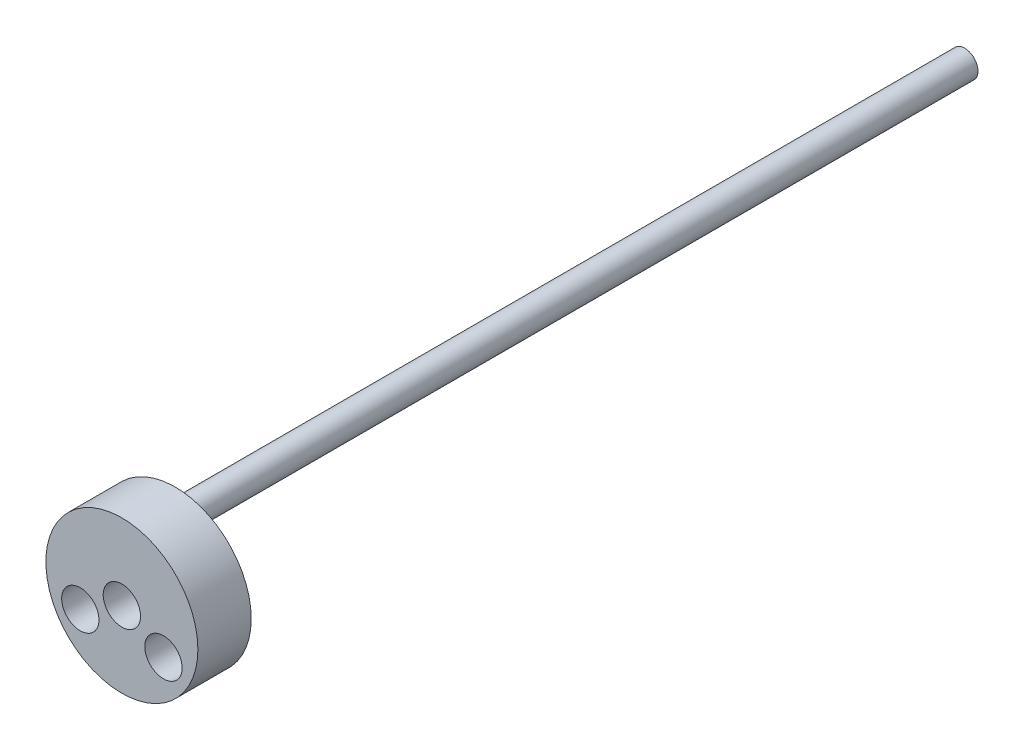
SolidWorks part; units mm, degrees
ref_plane "Face" through (0, 0, 0) normal (0, 0, 1) x (1, 0, 0)
ref_plane "Dessus" through (0, 0, 0) normal (0, 1, 0) x (1, 0, 0)
ref_plane "Droite" through (0, 0, 0) normal (1, 0, 0) x (0, 0, -1)
sketch "Esquisse1" plane through (0, 0, 0) normal (0, 0, 1) x (1, 0, 0)
  circle A0 centre (0, 0) radius 14.25
  circle A1 centre (0, 9) radius 3.5
  circle A2 centre (7.7942, -4.5) radius 3.5
  circle A3 centre (-7.7942, -4.5) radius 3.5
  circle A4 centre (0, 0) radius 3.5
  dimension "D1" = 28.5
  dimension "D2" = 7
  dimension "D4" = 7
  dimension "D3" = 9
extrude "Extrusion1" add sketch "Esquisse1" along normal blind 10
sketch "Esquisse2" plane through (0, 0, 10) normal (0, 0, 1) x (1, 0, 0)
  circle A0 centre (0, 9) radius 3.5 construction
  circle A1 centre (0, 9) radius 3.5
extrude "Extrusion2" add sketch "Esquisse2" against normal blind 8
sketch "Esquisse3" plane through (0, 0, 2) normal (0, 0, -1) x (-1, 0, 0)
  circle A0 centre (0, 9) radius 2.5
  dimension "D1" = 5
extrude "Extrusion3" add sketch "Esquisse3" along normal blind 150
